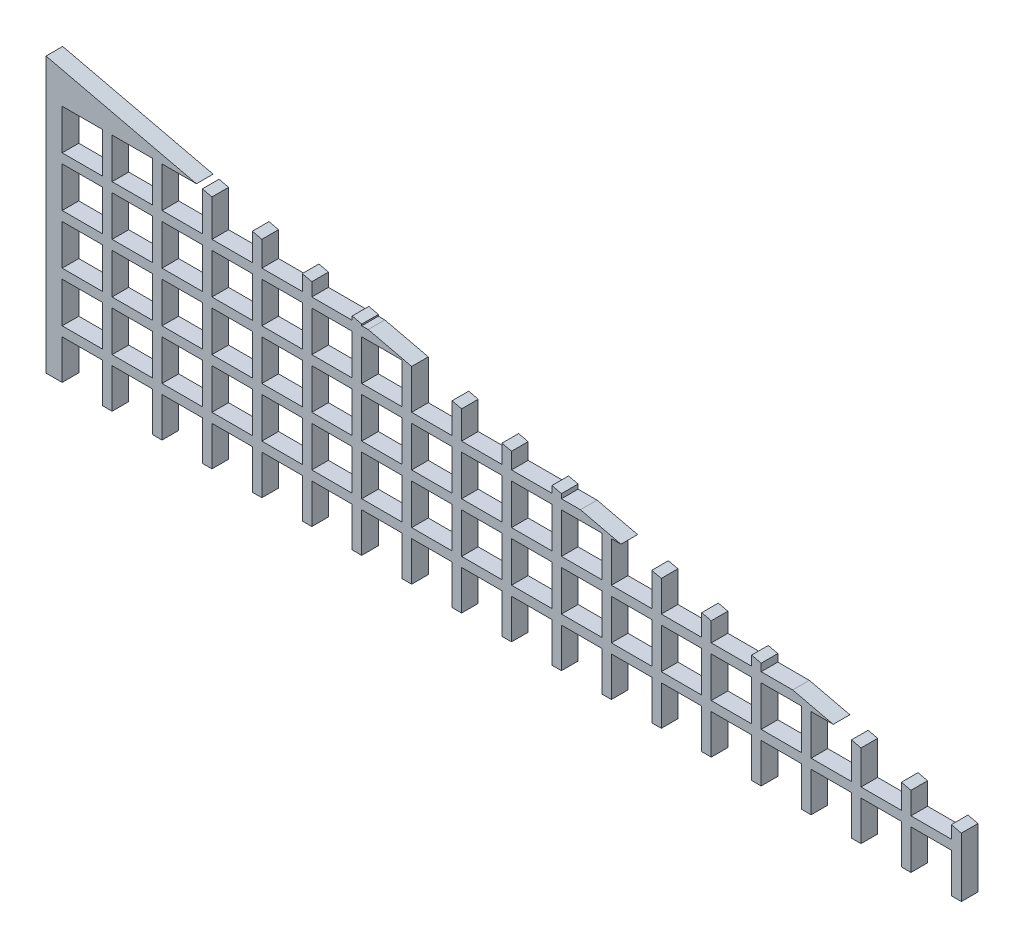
SolidWorks part; units mm, degrees
ref_plane "Front Plane" through (0, 0, 0) normal (0, 0, 1) x (1, 0, 0)
ref_plane "Top Plane" through (0, 0, 0) normal (0, 1, 0) x (1, 0, 0)
ref_plane "Right Plane" through (0, 0, 0) normal (1, 0, 0) x (0, 0, -1)
sketch "Sketch1" plane through (0, 0, 0) normal (0, 0, 1) x (1, 0, 0)
  line L0 (0, 0) -> (0, 41.91)
  line L1 (0, 41.91) -> (139.7, 9.0488)
  line L2 (139.7, 9.0488) -> (139.7, 0)
  line L3 (139.7, 0) -> (0, 0)
  line L4 (10.0866, 36.5087) -> (16.2511, 36.5087)
  line L5 (2.4666, 36.5087) -> (8.6311, 36.5087)
  line L6 (2.4666, 36.5087) -> (2.4666, 30.3442)
  line L7 (2.4666, 30.3442) -> (8.6311, 30.3442)
  line L8 (8.6311, 36.5087) -> (8.6311, 30.3442)
  line L9 (10.0866, 36.5087) -> (10.0866, 30.3442)
  line L10 (10.0866, 30.3442) -> (16.2511, 30.3442)
  line L11 (16.2511, 36.5087) -> (16.2511, 30.3442)
  line L12 (17.7066, 36.5087) -> (23.8711, 36.5087)
  line L13 (17.7066, 36.5087) -> (17.7066, 30.3442)
  line L14 (17.7066, 30.3442) -> (23.8711, 30.3442)
  line L15 (23.8711, 36.5087) -> (23.8711, 30.3442)
  line L16 (25.3266, 36.5087) -> (31.4911, 36.5087)
  line L17 (25.3266, 36.5087) -> (25.3266, 30.3442)
  line L18 (25.3266, 30.3442) -> (31.4911, 30.3442)
  line L19 (31.4911, 36.5087) -> (31.4911, 30.3442)
  line L20 (32.9466, 36.5087) -> (39.1111, 36.5087)
  line L21 (32.9466, 36.5087) -> (32.9466, 30.3442)
  line L22 (32.9466, 30.3442) -> (39.1111, 30.3442)
  line L23 (39.1111, 36.5087) -> (39.1111, 30.3442)
  line L24 (40.5666, 36.5087) -> (46.7311, 36.5087)
  line L25 (40.5666, 36.5087) -> (40.5666, 30.3442)
  line L26 (40.5666, 30.3442) -> (46.7311, 30.3442)
  line L27 (46.7311, 36.5087) -> (46.7311, 30.3442)
  line L28 (48.1866, 36.5087) -> (54.3511, 36.5087)
  line L29 (48.1866, 36.5087) -> (48.1866, 30.3442)
  line L30 (48.1866, 30.3442) -> (54.3511, 30.3442)
  line L31 (54.3511, 36.5087) -> (54.3511, 30.3442)
  line L32 (55.8066, 36.5087) -> (61.9711, 36.5087)
  line L33 (55.8066, 36.5087) -> (55.8066, 30.3442)
  line L34 (55.8066, 30.3442) -> (61.9711, 30.3442)
  line L35 (61.9711, 36.5087) -> (61.9711, 30.3442)
  line L36 (63.4266, 36.5087) -> (69.5911, 36.5087)
  line L37 (63.4266, 36.5087) -> (63.4266, 30.3442)
  line L38 (63.4266, 30.3442) -> (69.5911, 30.3442)
  line L39 (69.5911, 36.5087) -> (69.5911, 30.3442)
  line L40 (71.0466, 36.5087) -> (77.2111, 36.5087)
  line L41 (71.0466, 36.5087) -> (71.0466, 30.3442)
  line L42 (71.0466, 30.3442) -> (77.2111, 30.3442)
  line L43 (77.2111, 36.5087) -> (77.2111, 30.3442)
  line L44 (78.6666, 36.5087) -> (84.8311, 36.5087)
  line L45 (78.6666, 36.5087) -> (78.6666, 30.3442)
  line L46 (78.6666, 30.3442) -> (84.8311, 30.3442)
  line L47 (84.8311, 36.5087) -> (84.8311, 30.3442)
  line L48 (86.2866, 36.5087) -> (92.4511, 36.5087)
  line L49 (86.2866, 36.5087) -> (86.2866, 30.3442)
  line L50 (86.2866, 30.3442) -> (92.4511, 30.3442)
  line L51 (92.4511, 36.5087) -> (92.4511, 30.3442)
  line L52 (93.9066, 36.5087) -> (100.0711, 36.5087)
  line L53 (93.9066, 36.5087) -> (93.9066, 30.3442)
  line L54 (93.9066, 30.3442) -> (100.0711, 30.3442)
  line L55 (100.0711, 36.5087) -> (100.0711, 30.3442)
  line L56 (101.5266, 36.5087) -> (107.6911, 36.5087)
  line L57 (101.5266, 36.5087) -> (101.5266, 30.3442)
  line L58 (101.5266, 30.3442) -> (107.6911, 30.3442)
  line L59 (107.6911, 36.5087) -> (107.6911, 30.3442)
  line L60 (109.1466, 36.5087) -> (115.3111, 36.5087)
  line L61 (109.1466, 36.5087) -> (109.1466, 30.3442)
  line L62 (109.1466, 30.3442) -> (115.3111, 30.3442)
  line L63 (115.3111, 36.5087) -> (115.3111, 30.3442)
  line L64 (116.7666, 36.5087) -> (122.9311, 36.5087)
  line L65 (116.7666, 36.5087) -> (116.7666, 30.3442)
  line L66 (116.7666, 30.3442) -> (122.9311, 30.3442)
  line L67 (122.9311, 36.5087) -> (122.9311, 30.3442)
  line L68 (124.3866, 36.5087) -> (130.5511, 36.5087)
  line L69 (124.3866, 36.5087) -> (124.3866, 30.3442)
  line L70 (124.3866, 30.3442) -> (130.5511, 30.3442)
  line L71 (130.5511, 36.5087) -> (130.5511, 30.3442)
  line L72 (132.0066, 36.5087) -> (138.1711, 36.5087)
  line L73 (132.0066, 36.5087) -> (132.0066, 30.3442)
  line L74 (132.0066, 30.3442) -> (138.1711, 30.3442)
  line L75 (138.1711, 36.5087) -> (138.1711, 30.3442)
  line L76 (10.0866, 28.8887) -> (16.2511, 28.8887)
  line L77 (10.0866, 28.8887) -> (10.0866, 22.7242)
  line L78 (10.0866, 22.7242) -> (16.2511, 22.7242)
  line L79 (16.2511, 28.8887) -> (16.2511, 22.7242)
  line L80 (17.7066, 28.8887) -> (23.8711, 28.8887)
  line L81 (17.7066, 28.8887) -> (17.7066, 22.7242)
  line L82 (17.7066, 22.7242) -> (23.8711, 22.7242)
  line L83 (23.8711, 28.8887) -> (23.8711, 22.7242)
  line L84 (25.3266, 28.8887) -> (31.4911, 28.8887)
  line L85 (25.3266, 28.8887) -> (25.3266, 22.7242)
  line L86 (25.3266, 22.7242) -> (31.4911, 22.7242)
  line L87 (31.4911, 28.8887) -> (31.4911, 22.7242)
  line L88 (32.9466, 28.8887) -> (39.1111, 28.8887)
  line L89 (32.9466, 28.8887) -> (32.9466, 22.7242)
  line L90 (32.9466, 22.7242) -> (39.1111, 22.7242)
  line L91 (39.1111, 28.8887) -> (39.1111, 22.7242)
  line L92 (40.5666, 28.8887) -> (46.7311, 28.8887)
  line L93 (40.5666, 28.8887) -> (40.5666, 22.7242)
  line L94 (40.5666, 22.7242) -> (46.7311, 22.7242)
  line L95 (46.7311, 28.8887) -> (46.7311, 22.7242)
  line L96 (48.1866, 28.8887) -> (54.3511, 28.8887)
  line L97 (48.1866, 28.8887) -> (48.1866, 22.7242)
  line L98 (48.1866, 22.7242) -> (54.3511, 22.7242)
  line L99 (54.3511, 28.8887) -> (54.3511, 22.7242)
  line L100 (55.8066, 28.8887) -> (61.9711, 28.8887)
  line L101 (55.8066, 28.8887) -> (55.8066, 22.7242)
  line L102 (55.8066, 22.7242) -> (61.9711, 22.7242)
  line L103 (61.9711, 28.8887) -> (61.9711, 22.7242)
  line L104 (63.4266, 28.8887) -> (69.5911, 28.8887)
  line L105 (63.4266, 28.8887) -> (63.4266, 22.7242)
  line L106 (63.4266, 22.7242) -> (69.5911, 22.7242)
  line L107 (69.5911, 28.8887) -> (69.5911, 22.7242)
  line L108 (71.0466, 28.8887) -> (77.2111, 28.8887)
  line L109 (71.0466, 28.8887) -> (71.0466, 22.7242)
  line L110 (71.0466, 22.7242) -> (77.2111, 22.7242)
  line L111 (77.2111, 28.8887) -> (77.2111, 22.7242)
  line L112 (78.6666, 28.8887) -> (84.8311, 28.8887)
  line L113 (78.6666, 28.8887) -> (78.6666, 22.7242)
  line L114 (78.6666, 22.7242) -> (84.8311, 22.7242)
  line L115 (84.8311, 28.8887) -> (84.8311, 22.7242)
  line L116 (86.2866, 28.8887) -> (92.4511, 28.8887)
  line L117 (86.2866, 28.8887) -> (86.2866, 22.7242)
  line L118 (86.2866, 22.7242) -> (92.4511, 22.7242)
  line L119 (92.4511, 28.8887) -> (92.4511, 22.7242)
  line L120 (93.9066, 28.8887) -> (100.0711, 28.8887)
  line L121 (93.9066, 28.8887) -> (93.9066, 22.7242)
  line L122 (93.9066, 22.7242) -> (100.0711, 22.7242)
  line L123 (100.0711, 28.8887) -> (100.0711, 22.7242)
  line L124 (101.5266, 28.8887) -> (107.6911, 28.8887)
  line L125 (101.5266, 28.8887) -> (101.5266, 22.7242)
  line L126 (101.5266, 22.7242) -> (107.6911, 22.7242)
  line L127 (107.6911, 28.8887) -> (107.6911, 22.7242)
  line L128 (109.1466, 28.8887) -> (115.3111, 28.8887)
  line L129 (109.1466, 28.8887) -> (109.1466, 22.7242)
  line L130 (109.1466, 22.7242) -> (115.3111, 22.7242)
  line L131 (115.3111, 28.8887) -> (115.3111, 22.7242)
  line L132 (116.7666, 28.8887) -> (122.9311, 28.8887)
  line L133 (116.7666, 28.8887) -> (116.7666, 22.7242)
  line L134 (116.7666, 22.7242) -> (122.9311, 22.7242)
  line L135 (122.9311, 28.8887) -> (122.9311, 22.7242)
  line L136 (124.3866, 28.8887) -> (130.5511, 28.8887)
  line L137 (124.3866, 28.8887) -> (124.3866, 22.7242)
  line L138 (124.3866, 22.7242) -> (130.5511, 22.7242)
  line L139 (130.5511, 28.8887) -> (130.5511, 22.7242)
  line L140 (132.0066, 28.8887) -> (138.1711, 28.8887)
  line L141 (132.0066, 28.8887) -> (132.0066, 22.7242)
  line L142 (132.0066, 22.7242) -> (138.1711, 22.7242)
  line L143 (138.1711, 28.8887) -> (138.1711, 22.7242)
  line L144 (10.0866, 21.2687) -> (16.2511, 21.2687)
  line L145 (10.0866, 21.2687) -> (10.0866, 15.1042)
  line L146 (10.0866, 15.1042) -> (16.2511, 15.1042)
  line L147 (16.2511, 21.2687) -> (16.2511, 15.1042)
  line L148 (17.7066, 21.2687) -> (23.8711, 21.2687)
  line L149 (17.7066, 21.2687) -> (17.7066, 15.1042)
  line L150 (17.7066, 15.1042) -> (23.8711, 15.1042)
  line L151 (23.8711, 21.2687) -> (23.8711, 15.1042)
  line L152 (25.3266, 21.2687) -> (31.4911, 21.2687)
  line L153 (25.3266, 21.2687) -> (25.3266, 15.1042)
  line L154 (25.3266, 15.1042) -> (31.4911, 15.1042)
  line L155 (31.4911, 21.2687) -> (31.4911, 15.1042)
  line L156 (32.9466, 21.2687) -> (39.1111, 21.2687)
  line L157 (32.9466, 21.2687) -> (32.9466, 15.1042)
  line L158 (32.9466, 15.1042) -> (39.1111, 15.1042)
  line L159 (39.1111, 21.2687) -> (39.1111, 15.1042)
  line L160 (40.5666, 21.2687) -> (46.7311, 21.2687)
  line L161 (40.5666, 21.2687) -> (40.5666, 15.1042)
  line L162 (40.5666, 15.1042) -> (46.7311, 15.1042)
  line L163 (46.7311, 21.2687) -> (46.7311, 15.1042)
  line L164 (48.1866, 21.2687) -> (54.3511, 21.2687)
  line L165 (48.1866, 21.2687) -> (48.1866, 15.1042)
  line L166 (48.1866, 15.1042) -> (54.3511, 15.1042)
  line L167 (54.3511, 21.2687) -> (54.3511, 15.1042)
  line L168 (55.8066, 21.2687) -> (61.9711, 21.2687)
  line L169 (55.8066, 21.2687) -> (55.8066, 15.1042)
  line L170 (55.8066, 15.1042) -> (61.9711, 15.1042)
  line L171 (61.9711, 21.2687) -> (61.9711, 15.1042)
  line L172 (63.4266, 21.2687) -> (69.5911, 21.2687)
  line L173 (63.4266, 21.2687) -> (63.4266, 15.1042)
  line L174 (63.4266, 15.1042) -> (69.5911, 15.1042)
  line L175 (69.5911, 21.2687) -> (69.5911, 15.1042)
  line L176 (71.0466, 21.2687) -> (77.2111, 21.2687)
  line L177 (71.0466, 21.2687) -> (71.0466, 15.1042)
  line L178 (71.0466, 15.1042) -> (77.2111, 15.1042)
  line L179 (77.2111, 21.2687) -> (77.2111, 15.1042)
  line L180 (78.6666, 21.2687) -> (84.8311, 21.2687)
  line L181 (78.6666, 21.2687) -> (78.6666, 15.1042)
  line L182 (78.6666, 15.1042) -> (84.8311, 15.1042)
  line L183 (84.8311, 21.2687) -> (84.8311, 15.1042)
  line L184 (86.2866, 21.2687) -> (92.4511, 21.2687)
  line L185 (86.2866, 21.2687) -> (86.2866, 15.1042)
  line L186 (86.2866, 15.1042) -> (92.4511, 15.1042)
  line L187 (92.4511, 21.2687) -> (92.4511, 15.1042)
  line L188 (93.9066, 21.2687) -> (100.0711, 21.2687)
  line L189 (93.9066, 21.2687) -> (93.9066, 15.1042)
  line L190 (93.9066, 15.1042) -> (100.0711, 15.1042)
  line L191 (100.0711, 21.2687) -> (100.0711, 15.1042)
  line L192 (101.5266, 21.2687) -> (107.6911, 21.2687)
  line L193 (101.5266, 21.2687) -> (101.5266, 15.1042)
  line L194 (101.5266, 15.1042) -> (107.6911, 15.1042)
  line L195 (107.6911, 21.2687) -> (107.6911, 15.1042)
  line L196 (109.1466, 21.2687) -> (115.3111, 21.2687)
  line L197 (109.1466, 21.2687) -> (109.1466, 15.1042)
  line L198 (109.1466, 15.1042) -> (115.3111, 15.1042)
  line L199 (115.3111, 21.2687) -> (115.3111, 15.1042)
  line L200 (116.7666, 21.2687) -> (122.9311, 21.2687)
  line L201 (116.7666, 21.2687) -> (116.7666, 15.1042)
  line L202 (116.7666, 15.1042) -> (122.9311, 15.1042)
  line L203 (122.9311, 21.2687) -> (122.9311, 15.1042)
  line L204 (124.3866, 21.2687) -> (130.5511, 21.2687)
  line L205 (124.3866, 21.2687) -> (124.3866, 15.1042)
  line L206 (124.3866, 15.1042) -> (130.5511, 15.1042)
  line L207 (130.5511, 21.2687) -> (130.5511, 15.1042)
  line L208 (132.0066, 21.2687) -> (138.1711, 21.2687)
  line L209 (132.0066, 21.2687) -> (132.0066, 15.1042)
  line L210 (132.0066, 15.1042) -> (138.1711, 15.1042)
  line L211 (138.1711, 21.2687) -> (138.1711, 15.1042)
  line L212 (10.0866, 13.6487) -> (16.2511, 13.6487)
  line L213 (10.0866, 13.6487) -> (10.0866, 7.4842)
  line L214 (10.0866, 7.4842) -> (16.2511, 7.4842)
  line L215 (16.2511, 13.6487) -> (16.2511, 7.4842)
  line L216 (17.7066, 13.6487) -> (23.8711, 13.6487)
  line L217 (17.7066, 13.6487) -> (17.7066, 7.4842)
  line L218 (17.7066, 7.4842) -> (23.8711, 7.4842)
  line L219 (23.8711, 13.6487) -> (23.8711, 7.4842)
  line L220 (25.3266, 13.6487) -> (31.4911, 13.6487)
  line L221 (25.3266, 13.6487) -> (25.3266, 7.4842)
  line L222 (25.3266, 7.4842) -> (31.4911, 7.4842)
  line L223 (31.4911, 13.6487) -> (31.4911, 7.4842)
  line L224 (32.9466, 13.6487) -> (39.1111, 13.6487)
  line L225 (32.9466, 13.6487) -> (32.9466, 7.4842)
  line L226 (32.9466, 7.4842) -> (39.1111, 7.4842)
  line L227 (39.1111, 13.6487) -> (39.1111, 7.4842)
  line L228 (40.5666, 13.6487) -> (46.7311, 13.6487)
  line L229 (40.5666, 13.6487) -> (40.5666, 7.4842)
  line L230 (40.5666, 7.4842) -> (46.7311, 7.4842)
  line L231 (46.7311, 13.6487) -> (46.7311, 7.4842)
  line L232 (48.1866, 13.6487) -> (54.3511, 13.6487)
  line L233 (48.1866, 13.6487) -> (48.1866, 7.4842)
  line L234 (48.1866, 7.4842) -> (54.3511, 7.4842)
  line L235 (54.3511, 13.6487) -> (54.3511, 7.4842)
  line L236 (55.8066, 13.6487) -> (61.9711, 13.6487)
  line L237 (55.8066, 13.6487) -> (55.8066, 7.4842)
  line L238 (55.8066, 7.4842) -> (61.9711, 7.4842)
  line L239 (61.9711, 13.6487) -> (61.9711, 7.4842)
  line L240 (63.4266, 13.6487) -> (69.5911, 13.6487)
  line L241 (63.4266, 13.6487) -> (63.4266, 7.4842)
  line L242 (63.4266, 7.4842) -> (69.5911, 7.4842)
  line L243 (69.5911, 13.6487) -> (69.5911, 7.4842)
  line L244 (71.0466, 13.6487) -> (77.2111, 13.6487)
  line L245 (71.0466, 13.6487) -> (71.0466, 7.4842)
  line L246 (71.0466, 7.4842) -> (77.2111, 7.4842)
  line L247 (77.2111, 13.6487) -> (77.2111, 7.4842)
  line L248 (78.6666, 13.6487) -> (84.8311, 13.6487)
  line L249 (78.6666, 13.6487) -> (78.6666, 7.4842)
  line L250 (78.6666, 7.4842) -> (84.8311, 7.4842)
  line L251 (84.8311, 13.6487) -> (84.8311, 7.4842)
  line L252 (86.2866, 13.6487) -> (92.4511, 13.6487)
  line L253 (86.2866, 13.6487) -> (86.2866, 7.4842)
  line L254 (86.2866, 7.4842) -> (92.4511, 7.4842)
  line L255 (92.4511, 13.6487) -> (92.4511, 7.4842)
  line L256 (93.9066, 13.6487) -> (100.0711, 13.6487)
  line L257 (93.9066, 13.6487) -> (93.9066, 7.4842)
  line L258 (93.9066, 7.4842) -> (100.0711, 7.4842)
  line L259 (100.0711, 13.6487) -> (100.0711, 7.4842)
  line L260 (101.5266, 13.6487) -> (107.6911, 13.6487)
  line L261 (101.5266, 13.6487) -> (101.5266, 7.4842)
  line L262 (101.5266, 7.4842) -> (107.6911, 7.4842)
  line L263 (107.6911, 13.6487) -> (107.6911, 7.4842)
  line L264 (109.1466, 13.6487) -> (115.3111, 13.6487)
  line L265 (109.1466, 13.6487) -> (109.1466, 7.4842)
  line L266 (109.1466, 7.4842) -> (115.3111, 7.4842)
  line L267 (115.3111, 13.6487) -> (115.3111, 7.4842)
  line L268 (116.7666, 13.6487) -> (122.9311, 13.6487)
  line L269 (116.7666, 13.6487) -> (116.7666, 7.4842)
  line L270 (116.7666, 7.4842) -> (122.9311, 7.4842)
  line L271 (122.9311, 13.6487) -> (122.9311, 7.4842)
  line L272 (124.3866, 13.6487) -> (130.5511, 13.6487)
  line L273 (124.3866, 13.6487) -> (124.3866, 7.4842)
  line L274 (124.3866, 7.4842) -> (130.5511, 7.4842)
  line L275 (130.5511, 13.6487) -> (130.5511, 7.4842)
  line L276 (132.0066, 13.6487) -> (138.1711, 13.6487)
  line L277 (132.0066, 13.6487) -> (132.0066, 7.4842)
  line L278 (132.0066, 7.4842) -> (138.1711, 7.4842)
  line L279 (138.1711, 13.6487) -> (138.1711, 7.4842)
  line L280 (10.0866, 6.0287) -> (16.2511, 6.0287)
  line L281 (10.0866, 6.0287) -> (10.0866, -0.1358)
  line L282 (10.0866, -0.1358) -> (16.2511, -0.1358)
  line L283 (16.2511, 6.0287) -> (16.2511, -0.1358)
  line L284 (17.7066, 6.0287) -> (23.8711, 6.0287)
  line L285 (17.7066, 6.0287) -> (17.7066, -0.1358)
  line L286 (17.7066, -0.1358) -> (23.8711, -0.1358)
  line L287 (23.8711, 6.0287) -> (23.8711, -0.1358)
  line L288 (25.3266, 6.0287) -> (31.4911, 6.0287)
  line L289 (25.3266, 6.0287) -> (25.3266, -0.1358)
  line L290 (25.3266, -0.1358) -> (31.4911, -0.1358)
  line L291 (31.4911, 6.0287) -> (31.4911, -0.1358)
  line L292 (32.9466, 6.0287) -> (39.1111, 6.0287)
  line L293 (32.9466, 6.0287) -> (32.9466, -0.1358)
  line L294 (32.9466, -0.1358) -> (39.1111, -0.1358)
  line L295 (39.1111, 6.0287) -> (39.1111, -0.1358)
  line L296 (40.5666, 6.0287) -> (46.7311, 6.0287)
  line L297 (40.5666, 6.0287) -> (40.5666, -0.1358)
  line L298 (40.5666, -0.1358) -> (46.7311, -0.1358)
  line L299 (46.7311, 6.0287) -> (46.7311, -0.1358)
  line L300 (48.1866, 6.0287) -> (54.3511, 6.0287)
  line L301 (48.1866, 6.0287) -> (48.1866, -0.1358)
  line L302 (48.1866, -0.1358) -> (54.3511, -0.1358)
  line L303 (54.3511, 6.0287) -> (54.3511, -0.1358)
  line L304 (55.8066, 6.0287) -> (61.9711, 6.0287)
  line L305 (55.8066, 6.0287) -> (55.8066, -0.1358)
  line L306 (55.8066, -0.1358) -> (61.9711, -0.1358)
  line L307 (61.9711, 6.0287) -> (61.9711, -0.1358)
  line L308 (63.4266, 6.0287) -> (69.5911, 6.0287)
  line L309 (63.4266, 6.0287) -> (63.4266, -0.1358)
  line L310 (63.4266, -0.1358) -> (69.5911, -0.1358)
  line L311 (69.5911, 6.0287) -> (69.5911, -0.1358)
  line L312 (71.0466, 6.0287) -> (77.2111, 6.0287)
  line L313 (71.0466, 6.0287) -> (71.0466, -0.1358)
  line L314 (71.0466, -0.1358) -> (77.2111, -0.1358)
  line L315 (77.2111, 6.0287) -> (77.2111, -0.1358)
  line L316 (78.6666, 6.0287) -> (84.8311, 6.0287)
  line L317 (78.6666, 6.0287) -> (78.6666, -0.1358)
  line L318 (78.6666, -0.1358) -> (84.8311, -0.1358)
  line L319 (84.8311, 6.0287) -> (84.8311, -0.1358)
  line L320 (86.2866, 6.0287) -> (92.4511, 6.0287)
  line L321 (86.2866, 6.0287) -> (86.2866, -0.1358)
  line L322 (86.2866, -0.1358) -> (92.4511, -0.1358)
  line L323 (92.4511, 6.0287) -> (92.4511, -0.1358)
  line L324 (93.9066, 6.0287) -> (100.0711, 6.0287)
  line L325 (93.9066, 6.0287) -> (93.9066, -0.1358)
  line L326 (93.9066, -0.1358) -> (100.0711, -0.1358)
  line L327 (100.0711, 6.0287) -> (100.0711, -0.1358)
  line L328 (101.5266, 6.0287) -> (107.6911, 6.0287)
  line L329 (101.5266, 6.0287) -> (101.5266, -0.1358)
  line L330 (101.5266, -0.1358) -> (107.6911, -0.1358)
  line L331 (107.6911, 6.0287) -> (107.6911, -0.1358)
  line L332 (109.1466, 6.0287) -> (115.3111, 6.0287)
  line L333 (109.1466, 6.0287) -> (109.1466, -0.1358)
  line L334 (109.1466, -0.1358) -> (115.3111, -0.1358)
  line L335 (115.3111, 6.0287) -> (115.3111, -0.1358)
  line L336 (116.7666, 6.0287) -> (122.9311, 6.0287)
  line L337 (116.7666, 6.0287) -> (116.7666, -0.1358)
  line L338 (116.7666, -0.1358) -> (122.9311, -0.1358)
  line L339 (122.9311, 6.0287) -> (122.9311, -0.1358)
  line L340 (124.3866, 6.0287) -> (130.5511, 6.0287)
  line L341 (124.3866, 6.0287) -> (124.3866, -0.1358)
  line L342 (124.3866, -0.1358) -> (130.5511, -0.1358)
  line L343 (130.5511, 6.0287) -> (130.5511, -0.1358)
  line L344 (132.0066, 6.0287) -> (138.1711, 6.0287)
  line L345 (132.0066, 6.0287) -> (132.0066, -0.1358)
  line L346 (132.0066, -0.1358) -> (138.1711, -0.1358)
  line L347 (138.1711, 6.0287) -> (138.1711, -0.1358)
  line L348 (2.4666, 28.8887) -> (8.6311, 28.8887)
  line L349 (2.4666, 28.8887) -> (2.4666, 22.7242)
  line L350 (2.4666, 22.7242) -> (8.6311, 22.7242)
  line L351 (8.6311, 28.8887) -> (8.6311, 22.7242)
  line L352 (2.4666, 21.2687) -> (8.6311, 21.2687)
  line L353 (2.4666, 21.2687) -> (2.4666, 15.1042)
  line L354 (2.4666, 15.1042) -> (8.6311, 15.1042)
  line L355 (8.6311, 21.2687) -> (8.6311, 15.1042)
  line L356 (2.4666, 13.6487) -> (8.6311, 13.6487)
  line L357 (2.4666, 13.6487) -> (2.4666, 7.4842)
  line L358 (2.4666, 7.4842) -> (8.6311, 7.4842)
  line L359 (8.6311, 13.6487) -> (8.6311, 7.4842)
  line L360 (2.4666, 6.0287) -> (8.6311, 6.0287)
  line L361 (2.4666, 6.0287) -> (2.4666, -0.1358)
  line L362 (2.4666, -0.1358) -> (8.6311, -0.1358)
  line L363 (8.6311, 6.0287) -> (8.6311, -0.1358)
  dimension "D1" = 41.91
  dimension "D2" = 139.7
  dimension "D3" = 18
  dimension "D4" = 5
extrude "Boss-Extrude1" add sketch "Sketch1" along normal blind 2.54 contours L360 L363 L3 L281 L280 L283 L285 L284 L287 L289 L288 L291 L293 L292 L295 L297 L296 L299 L301 L300 L303 L305 L304 L307 L309 L308 L311 L313 L312 L315 L317 L316 L319 L321 L320 L323 L325 L324 L327
